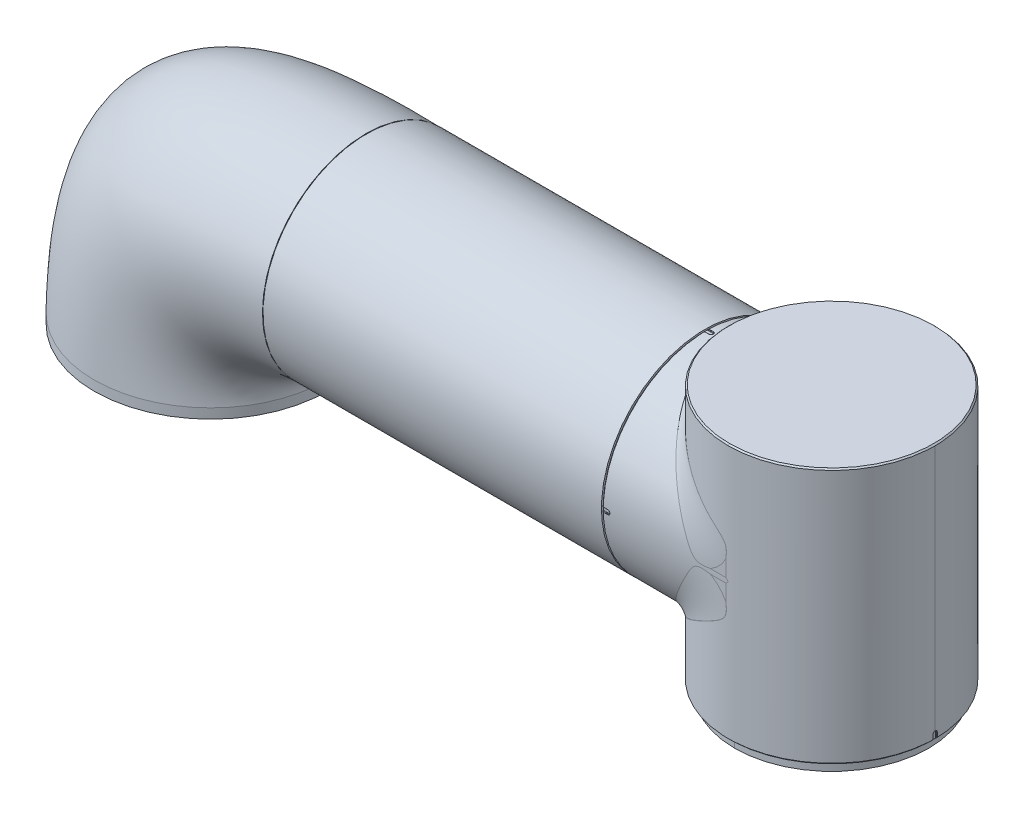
SolidWorks part; units mm, degrees
ref_plane "前视基准面" through (0, 0, 0) normal (0, 0, 1) x (1, 0, 0)
ref_plane "上视基准面" through (0, 0, 0) normal (0, 1, 0) x (1, 0, 0)
ref_plane "右视基准面" through (0, 0, 0) normal (1, 0, 0) x (0, 0, -1)
imported_body "小臂-1-solid1"
imported_body "小臂-1-solid2"
imported_body "14关节-1-solid1"
sketch "草图1" plane through (0, 0, 0) normal (0, 0, 1) x (1, 0, 0)
  line L0 (279.51, 96) -> (240.01, 96) construction
  line L1 (168.3188, 144.7797) -> (302.0037, 144.7797)
  line L2 (168.3188, 144.7797) -> (168.3188, 96)
  line L3 (168.3188, 96) -> (302.0037, 96)
  line L4 (302.0037, 144.7797) -> (302.0037, 96)
extrude "切除-拉伸1" cut sketch "草图1" against normal mid plane 221
ref_plane "基准面1" through (240.01, 0, 0) normal (1, 0, 0) x (0, 0, -1)
other "删除面1"
other "删除面2"
